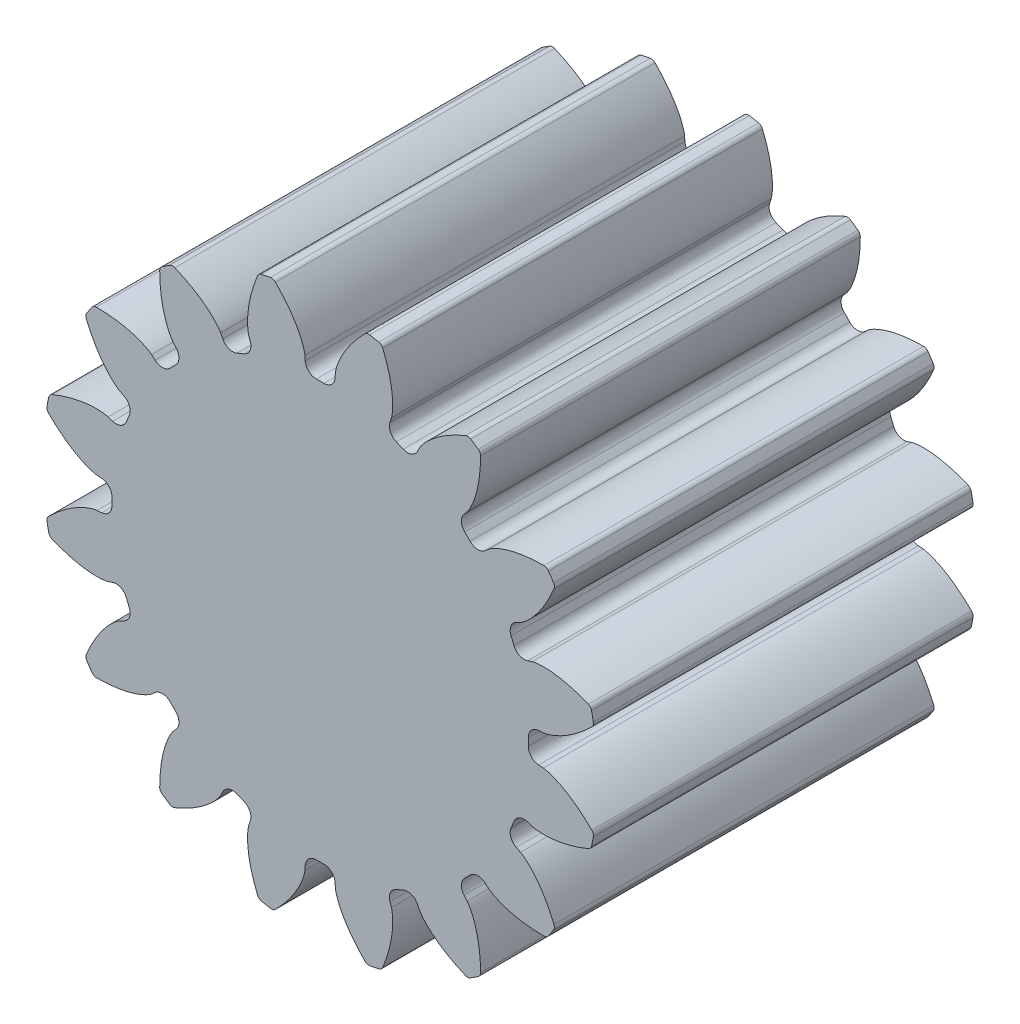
SolidWorks part; units mm, degrees
ref_plane "Front" through (0, 0, 0) normal (0, 0, 1) x (1, 0, 0)
ref_plane "Top" through (0, 0, 0) normal (0, 1, 0) x (1, 0, 0)
ref_plane "Right" through (0, 0, 0) normal (1, 0, 0) x (0, 0, -1)
sketch "Sketch1" plane through (0, 0, 0) normal (0, 0, 1) x (1, 0, 0)
  circle A0 centre (0, 0) radius 9.2869
extrude "Boss-Extrude1" add sketch "Sketch1" along normal blind 12.7
sketch "Sketch3" plane through (0, 0, 0) normal (0, 0, 1) x (1, 0, 0)
  line L0 (0, 0) -> (43.7181, 0) construction
  line L2 (0, 0) -> (-0.4747, 6.949) construction
  line L3 (0, 0) -> (0.4747, 6.949) construction
  line L4 (0.4747, 6.949) -> (0.5098, 7.4642) construction
  line L5 (0, 0) -> (0, 61.276) construction
  line L6 (-0.4747, 6.949) -> (-0.5098, 7.4642) construction
  circle A0 centre (0, 0) radius 9.2869 construction
  circle A1 centre (0, 0) radius 8.255 construction
  circle A2 centre (0, 0) radius 7.4816 construction
  arc A3 (0.4747, 6.949) -> (-0.4747, 6.949) centre (0, 0) ccw construction
  arc A5 (1.5667, 9.1538) -> (-1.5667, 9.1538) centre (0, 0) ccw
  spline S0 degree 4 poles (-0.5098, 7.4642) (-0.5101, 7.4672) (-0.5109, 7.4755) (-0.5131, 7.4912) (-0.5174, 7.5168) (-0.5241, 7.5492) (-0.5341, 7.5909) (-0.5477, 7.6397) (-0.5643, 7.6929) (-0.5843, 7.7504) (-0.606, 7.8073) (-0.6292, 7.8636) (-0.6537, 7.9193) (-0.6851, 7.9863) (-0.725, 8.0659) (-0.7749, 8.1578) (-0.8354, 8.2606) (-0.9011, 8.3638) (-0.9691, 8.4639) (-1.0416, 8.5634) (-1.1144, 8.6584) (-1.1938, 8.7553) (-1.269, 8.8438) (-1.3574, 8.9408) (-1.4299, 9.0184) (-1.5299, 9.1184) (-1.5902, 9.1767) (-1.6622, 9.2441) (-1.6949, 9.2736) (-1.7151, 9.2918) knots 0 0 0 0 0 0.005377 0.015084 0.028532 0.04661 0.064855 0.092111 0.119476 0.146842 0.174209 0.201575 0.228941 0.256307 0.307035 0.361767 0.4165 0.471232 0.525964 0.580697 0.635429 0.690161 0.744894 0.799626 0.854358 0.909091 0.954545 1 1 1 1 1 construction
  spline S1 degree 4 poles (-0.5098, 7.4642) (-0.5101, 7.4672) (-0.5109, 7.4755) (-0.5131, 7.4912) (-0.5174, 7.5168) (-0.5241, 7.5492) (-0.5341, 7.5909) (-0.5477, 7.6397) (-0.5643, 7.6929) (-0.5843, 7.7504) (-0.606, 7.8073) (-0.6292, 7.8636) (-0.6537, 7.9193) (-0.6851, 7.9863) (-0.725, 8.0659) (-0.7749, 8.1578) (-0.8354, 8.2606) (-0.9011, 8.3638) (-0.9691, 8.4639) (-1.0416, 8.5634) (-1.1144, 8.6584) (-1.1938, 8.7553) (-1.269, 8.8438) (-1.3574, 8.9408) (-1.4299, 9.0184) (-1.5082, 9.0967) (-1.5468, 9.1346) (-1.5667, 9.1538) knots 0 0 0 0 0 0.005377 0.015084 0.028532 0.04661 0.064855 0.092111 0.119476 0.146842 0.174209 0.201575 0.228941 0.256307 0.307035 0.361767 0.4165 0.471232 0.525964 0.580697 0.635429 0.690161 0.744894 0.799626 0.854358 0.909091 0.909091 0.909091 0.909091 0.909091
  spline S2 degree 4 poles (0.5098, 7.4642) (0.5101, 7.4672) (0.5109, 7.4755) (0.5131, 7.4912) (0.5174, 7.5168) (0.5241, 7.5492) (0.5341, 7.5909) (0.5477, 7.6397) (0.5643, 7.6929) (0.5843, 7.7504) (0.606, 7.8073) (0.6292, 7.8636) (0.6537, 7.9193) (0.6851, 7.9863) (0.725, 8.0659) (0.7749, 8.1578) (0.8354, 8.2606) (0.9011, 8.3638) (0.9691, 8.4639) (1.0416, 8.5634) (1.1144, 8.6584) (1.1938, 8.7553) (1.269, 8.8438) (1.3574, 8.9408) (1.4299, 9.0184) (1.5299, 9.1184) (1.5902, 9.1767) (1.6622, 9.2441) (1.6949, 9.2736) (1.7151, 9.2918) knots 0 0 0 0 0 0.005377 0.015084 0.028532 0.04661 0.064855 0.092111 0.119476 0.146842 0.174209 0.201575 0.228941 0.256307 0.307035 0.361767 0.4165 0.471232 0.525964 0.580697 0.635429 0.690161 0.744894 0.799626 0.854358 0.909091 0.954545 1 1 1 1 1 construction
  spline S3 degree 4 poles (0.5098, 7.4642) (0.5101, 7.4672) (0.5109, 7.4755) (0.5131, 7.4912) (0.5174, 7.5168) (0.5241, 7.5492) (0.5341, 7.5909) (0.5477, 7.6397) (0.5643, 7.6929) (0.5843, 7.7504) (0.606, 7.8073) (0.6292, 7.8636) (0.6537, 7.9193) (0.6851, 7.9863) (0.725, 8.0659) (0.7749, 8.1578) (0.8354, 8.2606) (0.9011, 8.3638) (0.9691, 8.4639) (1.0416, 8.5634) (1.1144, 8.6584) (1.1938, 8.7553) (1.269, 8.8438) (1.3574, 8.9408) (1.4299, 9.0184) (1.5082, 9.0967) (1.5468, 9.1346) (1.5667, 9.1538) knots 0 0 0 0 0 0.005377 0.015084 0.028532 0.04661 0.064855 0.092111 0.119476 0.146842 0.174209 0.201575 0.228941 0.256307 0.307035 0.361767 0.4165 0.471232 0.525964 0.580697 0.635429 0.690161 0.744894 0.799626 0.854358 0.909091 0.909091 0.909091 0.909091 0.909091
  point P0 (0, 6.9652)
sketch "DCLTBC" plane through (0, 0, 0) normal (0, 0, 1) x (1, 0, 0)
  line L0 (0, 0) -> (41.04, 0) construction
  line L1 (-0.4747, 6.949) -> (-0.5098, 7.4642) construction
  line L2 (0.4747, 6.949) -> (0.5098, 7.4642) construction
  line L3 (-0.4747, 6.949) -> (-0.5098, 7.4642)
  line L4 (0.4747, 6.949) -> (0.5098, 7.4642)
  line L5 (0, 0) -> (0, 104.9356) construction
  circle A0 centre (0, 0) radius 9.2869
  circle A1 centre (0, 0) radius 8.255 construction
  circle A2 centre (0, 0) radius 7.4816 construction
  arc A3 (0.4747, 6.949) -> (-0.4747, 6.949) centre (0, 0) ccw construction
  arc A4 (0.4747, 6.949) -> (-0.4747, 6.949) centre (0, 0) ccw
  spline S0 degree 4 poles (-997.0764, -74.8804) (-12.2992, 5.6182) (-0.6384, 6.7738) (-0.4569, 7.1598) (-0.5174, 7.5168) (-0.5241, 7.5492) (-0.5341, 7.5909) (-0.5477, 7.6397) (-0.5643, 7.6929) (-0.5843, 7.7504) (-0.606, 7.8073) (-0.6292, 7.8636) (-0.6537, 7.9193) (-0.6851, 7.9863) (-0.725, 8.0659) (-0.7749, 8.1578) (-0.8354, 8.2606) (-0.9011, 8.3638) (-0.9691, 8.4639) (-1.0416, 8.5634) (-1.1144, 8.6584) (-1.1938, 8.7553) (-1.269, 8.8438) (-1.3574, 8.9408) (-1.7438, 9.3544) (-3.2069, 10.6694) (16.2068, -8.2263) (-721.664, 702.994) knots -0.604217 -0.604217 -0.604217 -0.604217 -0.604217 0.005377 0.015084 0.028532 0.04661 0.064855 0.092111 0.119476 0.146842 0.174209 0.201575 0.228941 0.256307 0.307035 0.361767 0.4165 0.471232 0.525964 0.580697 0.635429 0.690161 0.744894 0.799626 0.854358 1.85661 1.85661 1.85661 1.85661 1.85661 only from (-0.5098, 7.4642) to (-1.5667, 9.1538) construction
  spline S1 degree 4 poles (997.0764, -74.8804) (12.2992, 5.6182) (0.6384, 6.7738) (0.4569, 7.1598) (0.5174, 7.5168) (0.5241, 7.5492) (0.5341, 7.5909) (0.5477, 7.6397) (0.5643, 7.6929) (0.5843, 7.7504) (0.606, 7.8073) (0.6292, 7.8636) (0.6537, 7.9193) (0.6851, 7.9863) (0.725, 8.0659) (0.7749, 8.1578) (0.8354, 8.2606) (0.9011, 8.3638) (0.9691, 8.4639) (1.0416, 8.5634) (1.1144, 8.6584) (1.1938, 8.7553) (1.269, 8.8438) (1.3574, 8.9408) (1.7438, 9.3544) (3.2069, 10.6694) (-16.2068, -8.2263) (721.664, 702.994) knots -0.604217 -0.604217 -0.604217 -0.604217 -0.604217 0.005377 0.015084 0.028532 0.04661 0.064855 0.092111 0.119476 0.146842 0.174209 0.201575 0.228941 0.256307 0.307035 0.361767 0.4165 0.471232 0.525964 0.580697 0.635429 0.690161 0.744894 0.799626 0.854358 1.85661 1.85661 1.85661 1.85661 1.85661 only from (0.5098, 7.4642) to (1.5667, 9.1538) construction
  spline S2 degree 4 poles (-0.5098, 7.4642) (-0.5101, 7.4672) (-0.5109, 7.4755) (-0.5131, 7.4912) (-0.5174, 7.5168) (-0.5241, 7.5492) (-0.5341, 7.5909) (-0.5477, 7.6397) (-0.5643, 7.6929) (-0.5843, 7.7504) (-0.606, 7.8073) (-0.6292, 7.8636) (-0.6537, 7.9193) (-0.6851, 7.9863) (-0.725, 8.0659) (-0.7749, 8.1578) (-0.8354, 8.2606) (-0.9011, 8.3638) (-0.9691, 8.4639) (-1.0416, 8.5634) (-1.1144, 8.6584) (-1.1938, 8.7553) (-1.269, 8.8438) (-1.3574, 8.9408) (-1.4299, 9.0184) (-1.5082, 9.0967) (-1.5468, 9.1346) (-1.5667, 9.1538) knots 0 0 0 0 0 0.005377 0.015084 0.028532 0.04661 0.064855 0.092111 0.119476 0.146842 0.174209 0.201575 0.228941 0.256307 0.307035 0.361767 0.4165 0.471232 0.525964 0.580697 0.635429 0.690161 0.744894 0.799626 0.854358 0.909091 0.909091 0.909091 0.909091 0.909091
  spline S3 degree 4 poles (0.5098, 7.4642) (0.5101, 7.4672) (0.5109, 7.4755) (0.5131, 7.4912) (0.5174, 7.5168) (0.5241, 7.5492) (0.5341, 7.5909) (0.5477, 7.6397) (0.5643, 7.6929) (0.5843, 7.7504) (0.606, 7.8073) (0.6292, 7.8636) (0.6537, 7.9193) (0.6851, 7.9863) (0.725, 8.0659) (0.7749, 8.1578) (0.8354, 8.2606) (0.9011, 8.3638) (0.9691, 8.4639) (1.0416, 8.5634) (1.1144, 8.6584) (1.1938, 8.7553) (1.269, 8.8438) (1.3574, 8.9408) (1.4299, 9.0184) (1.5082, 9.0967) (1.5468, 9.1346) (1.5667, 9.1538) knots 0 0 0 0 0 0.005377 0.015084 0.028532 0.04661 0.064855 0.092111 0.119476 0.146842 0.174209 0.201575 0.228941 0.256307 0.307035 0.361767 0.4165 0.471232 0.525964 0.580697 0.635429 0.690161 0.744894 0.799626 0.854358 0.909091 0.909091 0.909091 0.909091 0.909091
extrude "Cut-Extrude-DCLTBC" cut sketch "DCLTBC" along normal through all
fillet "Fillet-Tip-DCLTBC" radius 0.1835 2 edges at (1.5667, 9.1538, 6.35) (-1.5667, 9.1538, 6.35)
fillet "Fillet-Root-DCLTBC" radius 0.367 2 edges at (-0.4747, 6.949, 6.35) (0.4747, 6.949, 6.35)
pattern_circular "CirPattern-DCLTBC" count 16 over 360 about axis through (0, 0, 12.7) along (0, 0, 1) of "Cut-Extrude-DCLTBC", "Fillet-Tip-DCLTBC", "Fillet-Root-DCLTBC"
sketch "DCGTBC" [suppressed] plane through (0, 0, 0) normal (0, 0, 1) x (1, 0, 0)
  line L0 (0, 0) -> (41.04, 0) construction
  line L1 (-39.062, 3.4175) -> (0, 0) construction
  line L2 (0, 0) -> (39.062, 3.4175) construction
  line L3 (0, 0) -> (-16.5124, 0)
  line L5 (0, 0) -> (0, 104.9356) construction
  circle A0 centre (0, 0) radius 42.926
  circle A1 centre (0, 0) radius 41.275 construction
  circle A2 centre (0, 0) radius 37.4079 construction
  arc A3 (0.0565, 39.2112) -> (-0.0565, 39.2112) centre (0, 0) ccw construction
  arc A11 (39.062, 3.4175) -> (-39.062, 3.4175) centre (0, 0) ccw
  spline S4 degree 4 poles (999.7348, 13.8017) (14.7636, 34.9752) (0.2965, 35.8176) (-0.0051, 36.6892) (0.0631, 37.5633) (0.0733, 37.6597) (0.0895, 37.7842) (0.1125, 37.9306) (0.1419, 38.0912) (0.1784, 38.2657) (0.2187, 38.4394) (0.2625, 38.6124) (0.3095, 38.7844) (0.3702, 38.9923) (0.4484, 39.241) (0.5477, 39.5307) (0.6695, 39.858) (0.8035, 40.1902) (0.9435, 40.5159) (1.0942, 40.8434) (1.2465, 41.1592) (1.4142, 41.4855) (1.5737, 41.7858) (1.763, 42.1203) (2.4288, 43.2717) (4.5748, 46.5002) (-14.7523, 15.6397) (537.4106, 887.5799) knots -0.491463 -0.491463 -0.491463 -0.491463 -0.491463 0.005377 0.015084 0.028532 0.04661 0.064855 0.092111 0.119476 0.146842 0.174209 0.201575 0.228941 0.256307 0.307035 0.361767 0.4165 0.471232 0.525964 0.580697 0.635429 0.690161 0.744894 0.799626 0.854358 1.62619 1.62619 1.62619 1.62619 1.62619 only from (0.0539, 37.4078) to (2.2154, 42.8688) construction
  spline S5 degree 4 poles (-999.7348, 13.8017) (-14.7636, 34.9752) (-0.2965, 35.8176) (0.0051, 36.6892) (-0.0631, 37.5633) (-0.0733, 37.6597) (-0.0895, 37.7842) (-0.1125, 37.9306) (-0.1419, 38.0912) (-0.1784, 38.2657) (-0.2187, 38.4394) (-0.2625, 38.6124) (-0.3095, 38.7844) (-0.3702, 38.9923) (-0.4484, 39.241) (-0.5477, 39.5307) (-0.6695, 39.858) (-0.8035, 40.1902) (-0.9435, 40.5159) (-1.0942, 40.8434) (-1.2465, 41.1592) (-1.4142, 41.4855) (-1.5737, 41.7858) (-1.763, 42.1203) (-2.4288, 43.2717) (-4.5748, 46.5002) (14.7523, 15.6397) (-537.4106, 887.5799) knots -0.491463 -0.491463 -0.491463 -0.491463 -0.491463 0.005377 0.015084 0.028532 0.04661 0.064855 0.092111 0.119476 0.146842 0.174209 0.201575 0.228941 0.256307 0.307035 0.361767 0.4165 0.471232 0.525964 0.580697 0.635429 0.690161 0.744894 0.799626 0.854358 1.62619 1.62619 1.62619 1.62619 1.62619 only from (-0.0539, 37.4078) to (-2.2154, 42.8688) construction
  spline S6 degree 4 poles (0.0539, 37.4078) (0.054, 37.4166) (0.0547, 37.4411) (0.0572, 37.4876) (0.0631, 37.5633) (0.0733, 37.6597) (0.0895, 37.7842) (0.1125, 37.9306) (0.1419, 38.0912) (0.1784, 38.2657) (0.2187, 38.4394) (0.2625, 38.6124) (0.3095, 38.7844) (0.3702, 38.9923) (0.4484, 39.241) (0.5477, 39.5307) (0.6695, 39.858) (0.8035, 40.1902) (0.9435, 40.5159) (1.0942, 40.8434) (1.2465, 41.1592) (1.4142, 41.4855) (1.5737, 41.7858) (1.763, 42.1203) (1.9187, 42.3896) (2.0882, 42.666) (2.172, 42.8003) (2.2154, 42.8688) knots 0 0 0 0 0 0.005377 0.015084 0.028532 0.04661 0.064855 0.092111 0.119476 0.146842 0.174209 0.201575 0.228941 0.256307 0.307035 0.361767 0.4165 0.471232 0.525964 0.580697 0.635429 0.690161 0.744894 0.799626 0.854358 0.909091 0.909091 0.909091 0.909091 0.909091
  spline S7 degree 4 poles (-0.0539, 37.4078) (-0.054, 37.4166) (-0.0547, 37.4411) (-0.0572, 37.4876) (-0.0631, 37.5633) (-0.0733, 37.6597) (-0.0895, 37.7842) (-0.1125, 37.9306) (-0.1419, 38.0912) (-0.1784, 38.2657) (-0.2187, 38.4394) (-0.2625, 38.6124) (-0.3095, 38.7844) (-0.3702, 38.9923) (-0.4484, 39.241) (-0.5477, 39.5307) (-0.6695, 39.858) (-0.8035, 40.1902) (-0.9435, 40.5159) (-1.0942, 40.8434) (-1.2465, 41.1592) (-1.4142, 41.4855) (-1.5737, 41.7858) (-1.763, 42.1203) (-1.9187, 42.3896) (-2.0882, 42.666) (-2.172, 42.8003) (-2.2154, 42.8688) knots 0 0 0 0 0 0.005377 0.015084 0.028532 0.04661 0.064855 0.092111 0.119476 0.146842 0.174209 0.201575 0.228941 0.256307 0.307035 0.361767 0.4165 0.471232 0.525964 0.580697 0.635429 0.690161 0.744894 0.799626 0.854358 0.909091 0.909091 0.909091 0.909091 0.909091
  dimension "D1" = 5
  dimension "D2" = 5
extrude "Cut-Extrude-DCGTBC" [suppressed] cut sketch "DCGTBC" along normal through all
fillet "Fillet-Tip-DCGTBC" [suppressed] radius 0.1835
pattern_circular "CirPattern-DCGTBC" [suppressed] count 16 over 360
equation "\"DiametralPitch\" = 80 / 3.25'Diametral Pitch"
equation "\"NumTeeth\" = 80 / 5'Number of Teeth"
equation "\"PressureAngle\"= 25deg'Pressure Angle"
equation "\"Addendum\"= 1 / \"DiametralPitch\"'Addendum"
equation "\"Dedendum\"= 1.25 / \"DiametralPitch\"'Dedendum"
equation "\"WorkingDepth\"= 2 / \"DiametralPitch\"'Working Depth - here for REF (Not used in building model)"
equation "\"WholeDepth\"= 2.25 / \"DiametralPitch\"'Whole Depth - here for REF (Not used in building model)"
equation "\"Clearance\"= .25 / \"DiametralPitch\"'Clearance"
equation "\"CircularPitch\"= pi / \"DiametralPitch\"'Circular Pitch - here for REF (Not used in building model)"
equation "\"PitchCircle\"= \"NumTeeth\" / \"DiametralPitch\"'Pitch Circle - or - Pitch Diameter"
equation "\"OutsideDiameter\"= ( \"NumTeeth\" + 2 ) / \"DiametralPitch\"'Outside Diameter"
equation "\"Fillet_Root\"= \"Clearance\" * cos ( \"PressureAngle\" ) * tan ( ( 90 + \"PressureAngle\" ) / 2 ) 'Fillet Root"
equation "\"AddendumCircle\"= \"PitchCircle\" + ( 2 * \"Addendum\" )'Addendum Circle - or - Addendum Diameter"
equation "\"DedendumCircle\"= \"PitchCircle\" - ( 2 * \"Dedendum\" )'Dedendum Circle - or - Dedendum Diameter"
equation "\"BaseCircle\"= \"PitchCircle\" * cos ( \"PressureAngle\" )'Base Circle - Base Diameter"
equation "\"PitchAngle\"= 360deg / \"NumTeeth\"'Pitch Angle"
equation "\"Alpha\"= sqr ( \"PitchCircle\" ^ 2 - \"BaseCircle\" ^ 2 ) / \"BaseCircle\" * 180 / PI - \"PressureAngle\"'Alpha - Used for Calculating Beta"
equation "\"Beta\"= ( \"PitchAngle\" / 4 - ( \"Alpha\" - 90 ) )'Beta - Used in definition of the parameters for the parametric equation driven curve"
equation "\"Gamma\"= ( \"PitchAngle\" / 4 - ( \"Alpha\" + 90 ) )'Gamma - Used in definition of the parameters for the parametric equation driven curve"
equation "\"Phi\"= sqr ( ( \"AddendumCircle\" / 2 ) ^ 2 - ( \"BaseCircle\" / 2 ) ^ 2 ) / ( \"BaseCircle\" / 2 )'Phi - Used in definition of the parameters for the parametric equation driven curve"
equation "\"DCGTBC\"= iif ( \"DedendumCircle\" > \"BaseCircle\" , \"unsuppressed\" , \"suppressed\" )'if Dedendum Circle IS GREATER THAN BaseCircle THEN UnsuppressORSuppress FEATURE"
equation "\"DCLTBC\"= iif ( \"DedendumCircle\" - .002 > \"BaseCircle\" , \"suppressed\" , \"unsuppressed\" )'if Dedendum Circle - .002 IS GREATER THAN BaseCircle THEN SuppressORUnsuppress FEATURE"
equation "\"Cut-Extrude-DCGTBC\"= iif ( \"DedendumCircle\" > \"BaseCircle\" , \"unsuppressed\" , \"suppressed\" )'if Dedendum Circle IS GREATER THAN BaseCircle THEN UnsuppressORSuppress FEATURE"
equation "\"Cut-Extrude-DCLTBC\"= iif ( \"DedendumCircle\" - .002 > \"BaseCircle\" , \"suppressed\" , \"unsuppressed\" )'if Dedendum Circle - .002 IS GREATER THAN BaseCircle THEN SuppressORUnsuppress FEATURE"
equation "\"CirPattern-DCGTBC\"= iif ( \"DedendumCircle\" > \"BaseCircle\" , \"unsuppressed\" , \"suppressed\" )'if Dedendum Circle IS GREATER THAN BaseCircle THEN UnsuppressORSuppress FEATURE"
equation "\"CirPattern-DCLTBC\"= iif ( \"DedendumCircle\" - .002 > \"BaseCircle\" , \"suppressed\" , \"unsuppressed\" )'if Dedendum Circle - .002 IS GREATER THAN BaseCircle THEN SuppressORUnsuppress FEATURE"
equation "\"Fillet-Tip-DCGTBC\"= iif ( \"DedendumCircle\" > \"BaseCircle\" , \"unsuppressed\" , \"suppressed\" )'if Dedendum Circle IS GREATER THAN BaseCircle THEN UnsuppressORSuppress FEATURE"
equation "\"Fillet-Tip-DCLTBC\"= iif ( \"DedendumCircle\" - .002 > \"BaseCircle\" , \"suppressed\" , \"unsuppressed\" )'if Dedendum Circle - .002 IS GREATER THAN BaseCircle THEN SuppressORUnsuppress FEATURE"
equation "\"Fillet-Root-DCLTBC\"= iif ( \"DedendumCircle\" - .002 > \"BaseCircle\" , \"suppressed\" , \"unsuppressed\" )'if Dedendum Circle - .002 IS GREATER THAN BaseCircle THEN SuppressORUnsuppress FEATURE"
equation "\"D1@CirPattern-DCGTBC\"= \"NumTeeth\"'Number of Teeth"
equation "\"D1@CirPattern-DCLTBC\"= \"NumTeeth\"'Number of Teeth"
equation "\"D1@Fillet-Tip-DCGTBC\"= \"Fillet_Root\" / 2 'Tip Rad For Large No of Teeth"
equation "\"D1@Fillet-Tip-DCLTBC\"=\"Fillet_Root\" / 2'Tip Rad For Small No of Teeth"
equation "\"D1@Fillet-Root-DCLTBC\"= \"Fillet_Root\"'Fillet Root"
